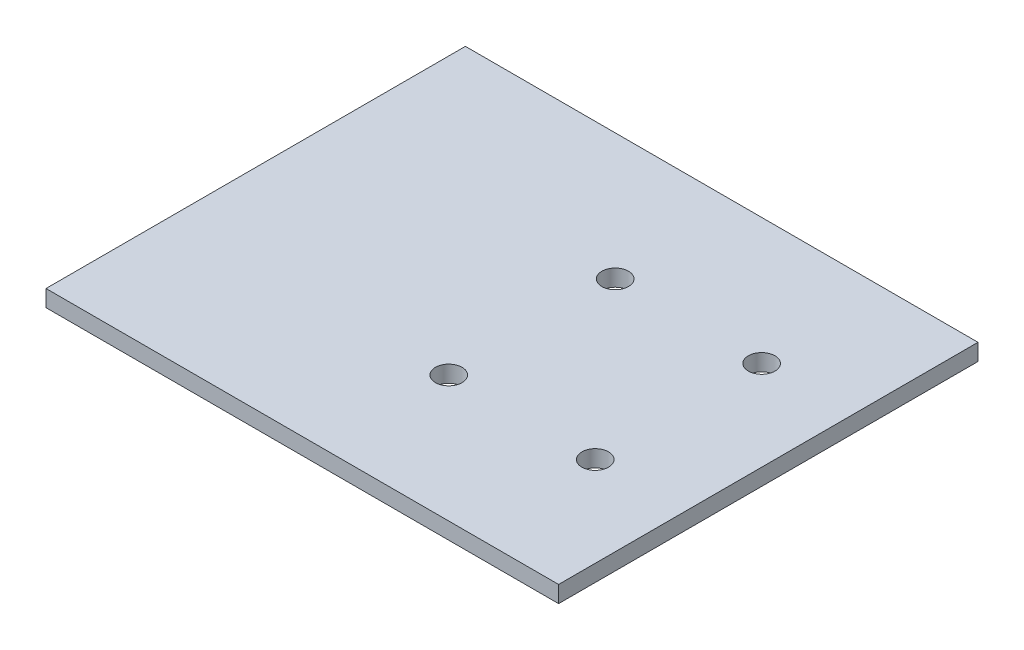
SolidWorks part; units mm, degrees
ref_plane "Front Plane" through (0, 0, 0) normal (0, 0, 1) x (1, 0, 0)
ref_plane "Top Plane" through (0, 0, 0) normal (0, 1, 0) x (1, 0, 0)
ref_plane "Right Plane" through (0, 0, 0) normal (1, 0, 0) x (0, 0, -1)
sketch "Sketch1" plane through (0, 0, 0) normal (0, 1, 0) x (1, 0, 0)
  line L0 (0, 0) -> (25, 0) construction
  line L1 (-38.5, 31.5) -> (38.5, 31.5)
  line L2 (-38.5, 31.5) -> (-38.5, -31.5)
  line L3 (-38.5, -31.5) -> (38.5, -31.5)
  line L4 (38.5, 31.5) -> (38.5, -31.5)
  line L5 (-38.5, 31.5) -> (38.5, -31.5) construction
  line L6 (-38.5, -31.5) -> (38.5, 31.5) construction
  line L7 (25, 12.5) -> (25, -12.5) construction
  circle A0 centre (25, 12.5) radius 2
  circle A1 centre (25, -12.5) radius 2
  circle A2 centre (3, 12.5) radius 2
  circle A3 centre (3, -12.5) radius 2
  point P0 (0, 0)
  dimension "D5" = 4
  dimension "D6" = 4
  dimension "D1" = 77
  dimension "D2" = 63
  dimension "D3" = 25
  dimension "D4" = 25
  dimension "D8" = 22
  dimension "D7" = 2
extrude "Boss-Extrude1" add sketch "Sketch1" along normal blind 2.5
